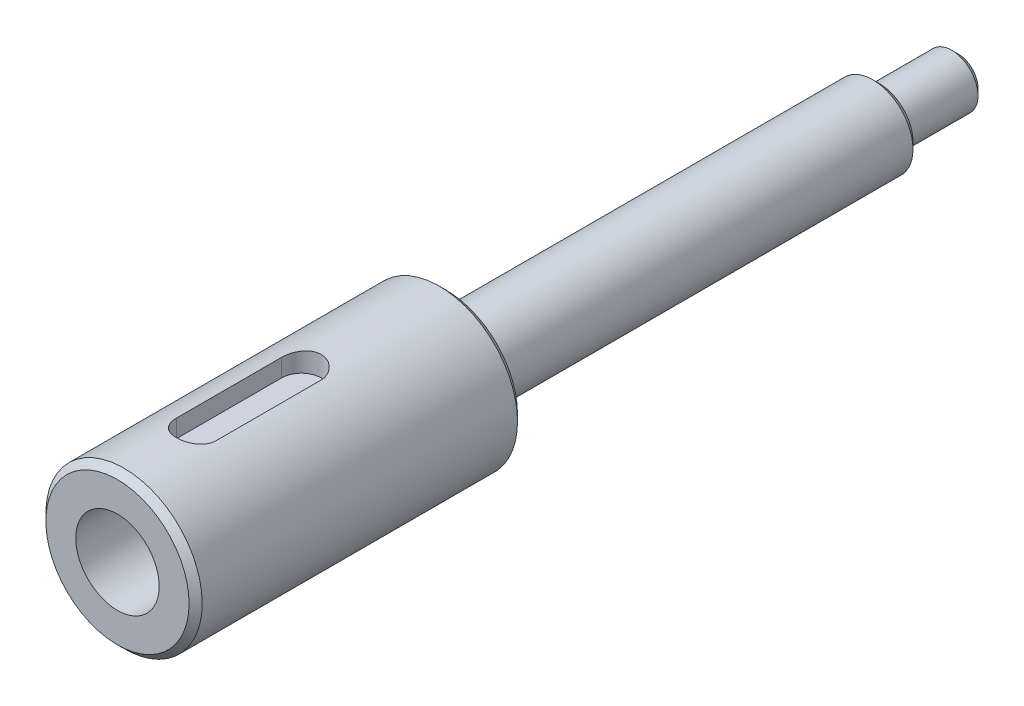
SolidWorks part; units mm, degrees
ref_plane "Plane1" through (0, 0, 0) normal (0, 0, 1) x (1, 0, 0)
ref_plane "Plane2" through (0, 0, 0) normal (0, 1, 0) x (1, 0, 0)
ref_plane "Plane3" through (0, 0, 0) normal (1, 0, 0) x (0, 0, -1)
sketch "Sketch1" plane through (0, 0, 0) normal (0, 0, 1) x (1, 0, 0)
  circle A2 centre (0, 0) radius 5.95
  dimension "D1" = 11.9
extrude "Base-Extrude" add sketch "Sketch1" along normal blind 25
sketch "Sketch3" plane through (0, 0, 0) normal (0, 0, -1) x (-1, 0, 0)
  circle A0 centre (0, 0) radius 3.05
  dimension "D1" = 6.1
extrude "Boss-Extrude1" add sketch "Sketch3" along normal blind 39
chamfer "Chamfer1" distance 0.5 angle 45 2 edges at (5.95, 0, 0) (5.95, 0, 25)
ref_plane "Plane4" through (0, 6, 0) normal (0, 1, 0) x (-1, 0, 0)
sketch "Sketch7" plane through (0, 6, 0) normal (0, 1, 0) x (-1, 0, 0)
  line L0 (0, 0) -> (0, 15) construction
  line L1 (5.95, 25) -> (-5.95, 25) construction
  line L2 (-1.5, 19) -> (-1.5, 11)
  line L4 (1.5, 19) -> (1.5, 11)
  arc A0 (1.5, 19) -> (-1.5, 19) centre (0, 19) ccw
  arc A1 (-1.5, 11) -> (1.5, 11) centre (0, 11) ccw
  dimension "D2" = 1.5
  dimension "D1" = 6
  dimension "D4" = 8
extrude "Cut-Extrude2" cut sketch "Sketch7" against normal blind 1.6
hole_wizard "M6.0 (6.000000) Diameter Hole1" positions "Sketch9" profile "Sketch8" hole size "M6.0" standard "ISO"
sketch "Sketch9" plane through (0, 0, 25) normal (0, 0, 1) x (1, 0, 0)
  point P0 (0, 0)
sketch "Sketch8" plane through (0, 0, 25) normal (1, 0, 0) x (0, -1, 0)
  line L0 (0, 0) -> (0, 23.4077)
  line L1 (0, 23.4077) -> (3.175, 21.5)
  line L2 (3.175, 21.5) -> (3.175, 0)
  line L5 (3.175, 0) -> (0, 0)
  line L10 (0, 23.4077) -> (-3.175, 21.5) construction
  line L11 (0, -6.35) -> (0, 107.95) construction
  dimension "Hole Dia." = 6.35
  dimension "Hole Depth" = 21.5
  dimension "Drill Angle" = 118
sketch "Sketch10" plane through (0, 0, -39) normal (0, 0, -1) x (-1, 0, 0)
  circle A0 centre (0, 0) radius 2
  circle A1 centre (0, 0) radius 3.05
  dimension "D1" = 4
  dimension "D2" = 6.1
extrude "Cut-Extrude3" cut sketch "Sketch10" against normal blind 6
chamfer "Chamfer2" distance 0.5 angle 45 2 edges at (-3.05, 0, -33) (-2, 0, -39)
sketch "Sketch11" plane through (0, 0, 0) normal (0, 1, 0) x (0, 0, -1)
  line L0 (-28.4596, 0) -> (48.9575, 0) construction
  line L1 (-25, 5.45) -> (-25, -5.45) construction
  circle A0 centre (-2.75, 0) radius 0.75
  dimension "D1" = 1.5
  dimension "D2" = 22.25
extrude "Cut-Extrude4" cut sketch "Sketch11" against normal blind 10
